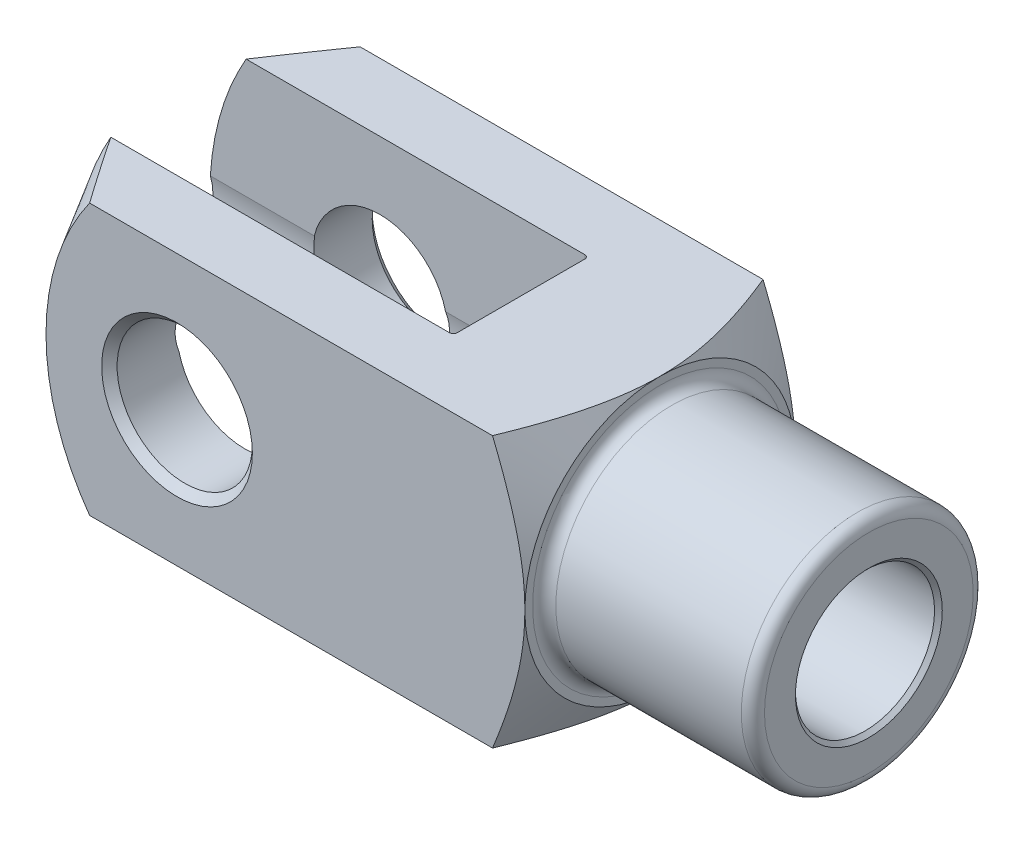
SolidWorks part; units mm, degrees
ref_plane "Front Plane" through (0, 0, 0) normal (0, 0, 1) x (1, 0, 0)
ref_plane "Top Plane" through (0, 0, 0) normal (0, 1, 0) x (1, 0, 0)
ref_plane "Right Plane" through (0, 0, 0) normal (1, 0, 0) x (0, 0, -1)
sketch "Sketch1" plane through (0, 0, 0) normal (1, 0, 0) x (0, 0, -1)
  line L0 (0, 0) -> (0, 50000) construction
  line L1 (0, 0) -> (50000, 0) construction
  line L2 (-35, -35) -> (-35, 35)
  line L3 (-35, 35) -> (35, 35)
  line L4 (35, -35) -> (35, 35)
  line L5 (-35, -35) -> (35, -35)
  point P9 (0, 35)
  point P11 (35, 0)
  point P12 (-35, 0)
  dimension "D1" = 70
  dimension "D2" = 70
extrude "Extrude1" add sketch "Sketch1" against normal blind 188
sketch "Sketch2" plane through (0, 0, 0) normal (1, 0, 0) x (0, 0, -1)
  circle A0 centre (0, 0) radius 30
  circle A1 centre (0, 0) radius 60
  dimension "D1" = 60
  dimension "D2" = 120
extrude "Extrude2" cut sketch "Sketch2" against normal blind 54
sketch "Sketch3" plane through (0, 0, 35) normal (0, 0, 1) x (1, 0, 0)
  circle A0 centre (-144, 0) radius 17.5
  dimension "D1" = 35
  dimension "D2" = 144
extrude "Extrude3" cut sketch "Sketch3" against normal through all
sketch "Sketch4" plane through (0, 35, 0) normal (0, 1, 0) x (1, 0, 0)
  line L0 (0, 0) -> (-50000, 0) construction
  line L1 (-188, -17.5) -> (-188, 17.5)
  line L2 (-188, 35) -> (-188, -35) construction
  line L3 (-188, 17.5) -> (-90, 17.5)
  line L4 (-90, 17.5) -> (-90, -17.5)
  line L5 (-144, 35) -> (-144, -35) construction
  line L6 (-188, -17.5) -> (-90, -17.5)
  point P7 (-144, 0)
  point P13 (-90, 0)
  point P14 (-188, 0)
  dimension "D1" = 54
  dimension "D2" = 35
extrude "Extrude4" cut sketch "Sketch4" against normal through all
fillet "Fillet1" radius 1 2 edges at (-90, 0, 17.5) (-90, 0, -17.5)
fillet "Fillet2" radius 3 2 edges at (0, 0, -30) (-54, 0, -30)
chamfer "Chamfer2" distance 2 angle 45 2 edges at (-126.5, 0, -35) (-126.5, 0, 35)
sketch "Sketch6" plane through (0, 0, 0) normal (0, 0, 1) x (1, 0, 0)
  line L0 (-54, -35) -> (-54, -70)
  line L1 (-54, -70) -> (-74.2073, -70)
  line L2 (-74.2073, -70) -> (-54, -35)
  dimension "D1" = 30
  dimension "D2" = 70
revolve "Cut-Revolve1" cut sketch "Sketch6" angle 360 about axis through (-54, 0, 0) along (1, 0, 0)
sketch "Sketch7" plane through (0, 0, 0) normal (0, 1, 0) x (1, 0, 0)
  line L0 (-177.8964, -35) -> (-188, -17.5)
  line L1 (-188, 17.5) -> (-177.8964, 35)
  line L2 (-177.8964, 35) -> (-258, 35)
  line L3 (-188, 17.5) -> (-188, -17.5)
  line L4 (-258, 35) -> (-258, -35)
  line L5 (-258, -35) -> (-177.8964, -35)
  line L6 (-188, 35) -> (-62.3701, 35) construction
  line L7 (-188, -35) -> (-62.3701, -35) construction
  line L8 (-118, 0.6162) -> (-118, 50000.6162) construction
  dimension "D1" = 120
  dimension "D2" = 70
  dimension "D3" = 70
revolve "Cut-Revolve2" cut sketch "Sketch7" angle 180 about L8
sketch "Sketch8" plane through (0, 0, 0) normal (1, 0, 0) x (0, 0, -1)
  circle A0 centre (0, 0) radius 18
  dimension "D1" = 36
extrude "Extrude5" cut sketch "Sketch8" against normal through all
chamfer "Chamfer3" distance 1 angle 45 1 edges at (0, 0, -18)
equation "\"D2@Sketch1\" = \"D1@Sketch1\""
equation "\"D2@Sketch2\" = \"D1@Sketch2\"*2"
equation "\"D2@Sketch6\" = \"D1@Sketch1\""
equation "\"D2@Sketch7\" = \"D1@Sketch1\""
equation "\"D3@Sketch7\" = \"D1@Sketch1\""
